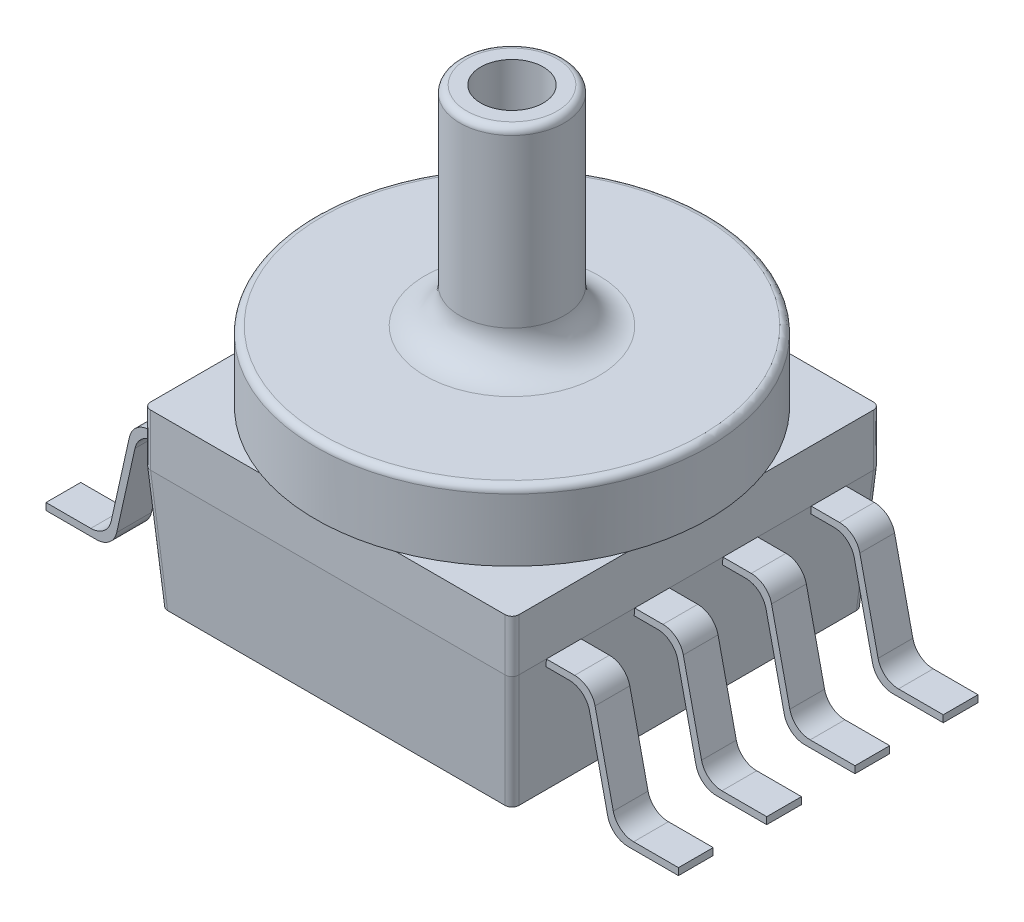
SolidWorks part; units mm, degrees
ref_plane "Plano frontal" through (0, 0, 0) normal (0, 0, 1) x (1, 0, 0)
ref_plane "Plano superior" through (0, 0, 0) normal (0, 1, 0) x (1, 0, 0)
ref_plane "Plano direito" through (0, 0, 0) normal (1, 0, 0) x (0, 0, -1)
sketch "Esboço1" plane through (0, 0, 0) normal (0, 1, 0) x (1, 0, 0)
  line L1 (-5.3, -5.3) -> (5.3, -5.3)
  line L2 (-5.3, -5.3) -> (-5.3, 5.3)
  line L3 (-5.3, 5.3) -> (5.3, 5.3)
  line L4 (5.3, -5.3) -> (5.3, 5.3)
  line L5 (-5.3, -5.3) -> (5.3, 5.3) construction
  line L6 (-5.3, 5.3) -> (5.3, -5.3) construction
  point P0 (0, 0)
  dimension "D1" = 10.6
  dimension "D2" = 10.6
extrude "Ressalto-extrusão1" add sketch "Esboço1" along normal blind 1.5 and the other way blind 3.5 draft 4
sketch "Esboço2" plane through (0, 0, 0) normal (0, 0, 1) x (1, 0, 0)
  line L0 (0, 0) -> (0, 9.5) construction
  line L1 (0, 1.5) -> (-5.65, 1.5)
  line L2 (-5.3, 1.5) -> (5.3, 1.5) construction
  line L3 (-5.65, 1.5) -> (-5.65, 3.5)
  line L4 (-5.65, 3.5) -> (-1.5, 3.5)
  line L5 (-1.5, 3.5) -> (-1.5, 9.5)
  line L6 (-1.5, 9.5) -> (0, 9.5)
  line L7 (-5.0553, -3.5) -> (5.0553, -3.5) construction
  line L8 (0, 1.5) -> (0, 9.5)
  dimension "D1" = 13
  dimension "D2" = 6
  dimension "D3" = 3
  dimension "D4" = 11.3
revolve "Revolução1" add sketch "Esboço2" angle 360 about L0
fillet "Filete1" radius 1 1 edges at (0, 3.5, -1.5)
sketch "Esboço3" plane through (0, 9.5, 0) normal (0, 1, 0) x (1, 0, 0)
  circle A0 centre (0, 0) radius 0.9
  dimension "D1" = 1.8
extrude "Corte-extrusão1" cut sketch "Esboço3" against normal blind 8
fillet "Filete2" radius 0.2 10 edges at (5.3, 0.75, 5.3) (5.3, 0.75, -5.3) (-5.3, 0.75, -5.3) (-5.3, 0.75, 5.3) (0, 3.5, -5.65) (0, 9.5, -1.5) (5.1776, -1.75, 5.1776) (-5.1776, -1.75, 5.1776) (-5.1776, -1.75, -5.1776) (5.1776, -1.75, -5.1776)
ref_plane "Plano1" through (0, 0, 3.81) normal (0, 0, 1) x (1, 0, 0)
sketch "Esboço4" plane through (0, 0, 3.81) normal (0, 0, 1) x (1, 0, 0)
  line L0 (0, 0) -> (0, -4.5224) construction
  line L1 (-5.1, 0) -> (5.1, 0) construction
  line L2 (-5.1, 0) -> (-6.1141, 0)
  line L3 (-5.1, 1.5) -> (-5.1, 0) construction
  line L4 (-6.6998, -0.4697) -> (-7.2249, -2.8303)
  line L5 (-7.8106, -3.3) -> (-9.1, -3.3)
  line L6 (-9.1, -3.3) -> (-9.1, -3.5)
  line L7 (-9.1, -3.5) -> (-7.6502, -3.5)
  line L8 (-7.0645, -3.0303) -> (-6.5394, -0.6697)
  line L9 (-5.9537, -0.2) -> (-5.0865, -0.2)
  line L10 (-5.1005, 0) -> (-4.8557, -3.5) construction
  line L11 (-5.0865, -0.2) -> (-5.1, 0)
  line L12 (-4.8557, -3.5) -> (4.8557, -3.5) construction
  line L13 (5.0865, -0.2) -> (5.1, 0)
  line L14 (5.9537, -0.2) -> (5.0865, -0.2)
  line L15 (7.0645, -3.0303) -> (6.5394, -0.6697)
  line L16 (9.1, -3.5) -> (7.6502, -3.5)
  line L17 (9.1, -3.3) -> (9.1, -3.5)
  line L18 (7.8106, -3.3) -> (9.1, -3.3)
  line L19 (6.6998, -0.4697) -> (7.2249, -2.8303)
  line L20 (5.1, 0) -> (6.1141, 0)
  arc A0 (-7.6502, -3.5) -> (-7.0645, -3.0303) centre (-7.6502, -2.9) ccw
  arc A1 (-7.2249, -2.8303) -> (-7.8106, -3.3) centre (-7.8106, -2.7) cw
  arc A2 (-6.1141, 0) -> (-6.6998, -0.4697) centre (-6.1141, -0.6) ccw
  arc A3 (-6.5394, -0.6697) -> (-5.9537, -0.2) centre (-5.9537, -0.8) cw
  arc A4 (6.5394, -0.6697) -> (5.9537, -0.2) centre (5.9537, -0.8) ccw
  arc A5 (6.1141, 0) -> (6.6998, -0.4697) centre (6.1141, -0.6) cw
  arc A6 (7.2249, -2.8303) -> (7.8106, -3.3) centre (7.8106, -2.7) ccw
  arc A7 (7.6502, -3.5) -> (7.0645, -3.0303) centre (7.6502, -2.9) cw
  dimension "D5" = 0.6
  dimension "D1" = 0.2
  dimension "D2" = 0.2
  dimension "D3" = 0.2
  dimension "D4" = 18.2
extrude "Ressalto-extrusão2" add sketch "Esboço4" along normal mid plane 1
pattern_linear "Padrão linear1" count 4 spacing 2.54 along (0, 0, -1) of "Ressalto-extrusão2"
